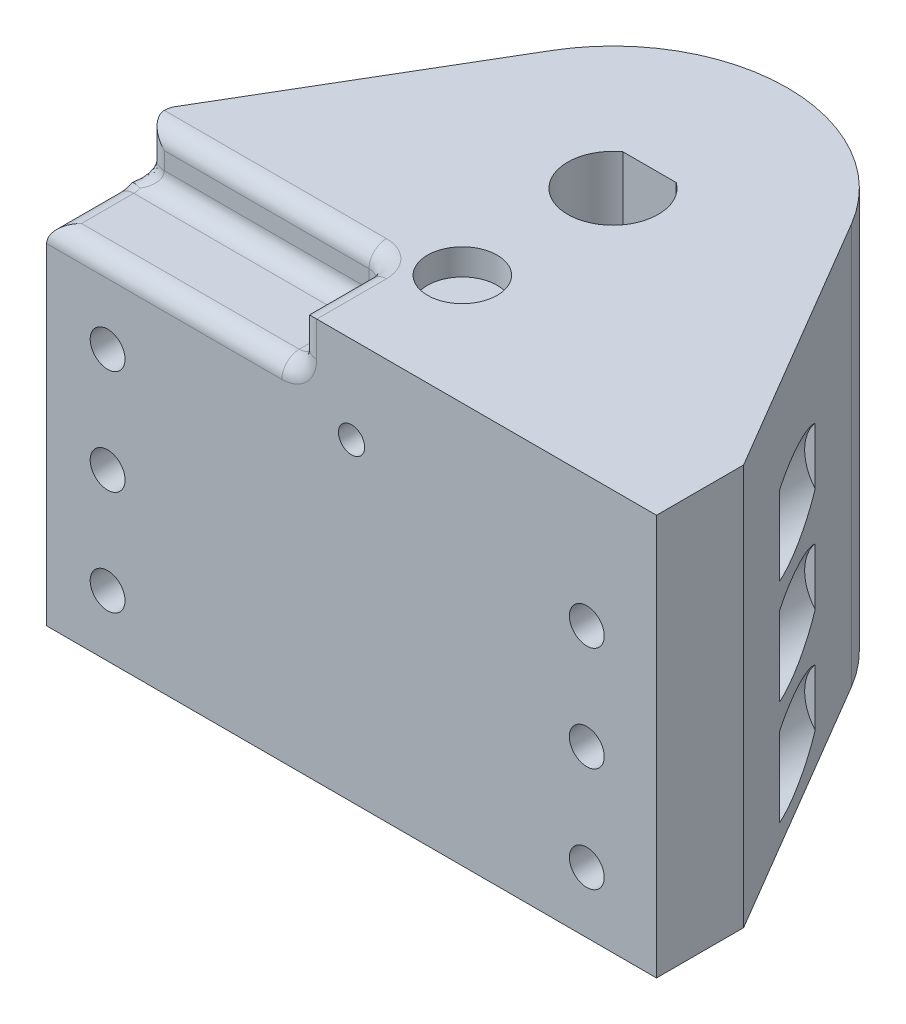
SolidWorks part; units mm, degrees
ref_plane "前视基准面" through (0, 0, 0) normal (0, 0, 1) x (1, 0, 0)
ref_plane "上视基准面" through (0, 0, 0) normal (0, 1, 0) x (1, 0, 0)
ref_plane "右视基准面" through (0, 0, 0) normal (1, 0, 0) x (0, 0, -1)
sketch "草图1" plane through (0, 0, 0) normal (0, 1, 0) x (1, 0, 0)
  line L1 (-35, 25.5) -> (-37.1794, 25.5)
  line L2 (-70, 0) -> (-52.2308, 30.1538)
  line L3 (0, 0) -> (-17.7692, 30.1538)
  line L4 (-37.3979, 25.5) -> (-32.6021, 25.5)
  line L7 (-70, 0) -> (-70, -10)
  line L8 (-70, -10) -> (0, -10)
  line L9 (0, 0) -> (0, -10)
  arc A0 (-17.7692, 30.1538) -> (-52.2308, 30.1538) centre (-35, 20) ccw
  arc A4 (-40.4, 17.3847) -> (-32.6021, 25.5) centre (-35, 20) ccw
  arc A5 (-40.4, 17.3847) -> (-40.4, 22.6153) centre (-35, 20) cw
  arc A6 (-37.3979, 25.5) -> (-40.4, 22.6153) centre (-35, 20) ccw
extrude "凸台-拉伸1" add sketch "草图1" along normal blind 40
sketch "草图2" plane through (0, 0, 10) normal (0, 0, 1) x (1, 0, 0)
  circle A0 centre (-63, 20) radius 2
  circle A1 centre (-8, 20) radius 2
  circle A2 centre (-63, 8) radius 2
  circle A3 centre (-8, 8) radius 2
  circle A4 centre (-63, 32) radius 2
  circle A5 centre (-8, 32) radius 2
extrude "切除-拉伸1" cut sketch "草图2" against normal blind 40
ref_plane "基准面1" through (0, 0, -20) normal (0, 0, 1) x (1, 0, 0)
sketch "草图3" plane through (0, 0, -20) normal (0, 0, 1) x (1, 0, 0)
  circle A0 centre (-8, 32) radius 5
  circle A1 centre (-8, 20) radius 5
  circle A2 centre (-8, 8) radius 5
  circle A3 centre (-63, 8) radius 5
  circle A4 centre (-63, 20) radius 5
  circle A5 centre (-63, 32) radius 5
  dimension "D1" = 10
  dimension "D2" = 10
  dimension "D3" = 10
  dimension "D4" = 10
  dimension "D5" = 10
  dimension "D6" = 10
extrude "切除-拉伸2" cut sketch "草图3" along normal blind 10
sketch "草图7" plane through (0, 0, 10) normal (0, 0, 1) x (1, 0, 0)
  line L0 (-70, 40) -> (-70, 0) construction
  line L1 (0, 40) -> (-70, 40)
  line L2 (0, 40) -> (0, 39)
  line L3 (0, 39) -> (-70, 39)
  line L4 (-70, 40) -> (-70, 39)
  line L6 (0, 0) -> (-70, 0)
  line L7 (0, 0) -> (0, 1)
  line L8 (0, 1) -> (-70, 1)
  line L9 (-70, 0) -> (-70, 1)
extrude "切除-拉伸5" cut sketch "草图7" against normal blind 54
sketch "草图8" plane through (0, 39, 0) normal (0, 1, 0) x (1, 0, 0)
  line L10 (-52.2308, 30.1538) -> (-70, 0)
  line L11 (-70, 0) -> (-70, -10)
  line L12 (-70, -10) -> (0, -10)
  line L13 (0, -10) -> (0, 0)
  line L14 (0, 0) -> (-17.7692, 30.1538)
  line L15 (-52.2308, 30.1538) -> (-70, 0)
  line L16 (-70, 0) -> (-70, -10)
  line L17 (-70, -10) -> (0, -10)
  line L18 (0, -10) -> (0, 0)
  line L19 (0, 0) -> (-17.7692, 30.1538)
  line L38 (-32.6021, 25.5) -> (-37.3979, 25.5)
  line L39 (-32.6021, 25.5) -> (-37.3979, 25.5)
  arc A2 (-17.7692, 30.1538) -> (-52.2308, 30.1538) centre (-35, 20) ccw
  arc A3 (-17.7692, 30.1538) -> (-52.2308, 30.1538) centre (-35, 20) ccw
  arc A9 (-37.3979, 25.5) -> (-32.6021, 25.5) centre (-35, 20) ccw
  arc A10 (-37.3979, 25.5) -> (-32.6021, 25.5) centre (-35, 20) ccw
  dimension "D1" = 0
  dimension "D2" = 0
extrude "凸台-拉伸2" add sketch "草图8" along normal blind 8
sketch "草图9" plane through (0, 0, 10) normal (0, 0, 1) x (1, 0, 0)
  line L0 (-70, 47) -> (0, 47) construction
  circle A0 centre (-35, 37) radius 1.5
  dimension "D1" = 10
extrude "切除-拉伸6" cut sketch "草图9" against normal blind 74
sketch "草图10" plane through (0, 47, 0) normal (0, 1, 0) x (1, 0, 0)
  circle A0 centre (-35, 2.7133) radius 4
  dimension "D1" = 8
extrude "切除-拉伸7" cut sketch "草图10" against normal blind 3
sketch "草图11" plane through (0, 47, 0) normal (0, 1, 0) x (1, 0, 0)
  line L0 (-32.8206, 24.5) -> (-37.1794, 24.5)
  line L11 (-32.6021, 25.5) -> (-37.3979, 25.5)
  line L12 (-32.6021, 25.5) -> (-37.3979, 25.5)
  arc A0 (-37.1794, 24.5) -> (-32.8206, 24.5) centre (-35, 20) ccw
  arc A7 (-37.3979, 25.5) -> (-32.6021, 25.5) centre (-35, 20) ccw
  arc A8 (-37.3979, 25.5) -> (-32.6021, 25.5) centre (-35, 20) ccw
  dimension "D2" = 0
extrude "凸台-拉伸3" add sketch "草图11" against normal up to surface (46 mm away)
sketch "草图13" plane through (0, 1, 0) normal (0, -1, 0) x (1, 0, 0)
  line L11 (-37.1794, -24.5) -> (-32.8206, -24.5)
  line L12 (-37.1794, -24.5) -> (-32.8206, -24.5)
  arc A10 (-32.8206, -24.5) -> (-37.1794, -24.5) centre (-35, -20) ccw
  arc A11 (-32.8206, -24.5) -> (-37.1794, -24.5) centre (-35, -20) ccw
  dimension "D3" = 0
extrude "凸台-拉伸4" add sketch "草图13" against normal blind 15
sketch "草图14" plane through (0, 1, 0) normal (0, -1, 0) x (1, 0, 0)
  circle A0 centre (-35.1438, -4.0006) radius 1.5
  circle A1 centre (-50.9994, -20.1438) radius 1.5
  circle A2 centre (-34.8562, -35.9994) radius 1.5
  circle A3 centre (-19.0006, -19.8562) radius 1.5
  circle A4 centre (-35.1438, -19.8562) radius 1.5
extrude "切除-拉伸8" cut sketch "草图14" against normal blind 20
sketch "草图15" plane through (0, 0, 10) normal (0, 0, 1) x (1, 0, 0)
  circle A0 centre (-35, 37) radius 1.5
extrude "切除-拉伸9" cut sketch "草图15" against normal blind 57
sketch "草图16" plane through (0, 47, 0) normal (0, 1, 0) x (1, 0, 0)
  line L2 (-35, 24) -> (-38, 24)
  line L3 (-38, 24) -> (-32, 24)
  line L7 (-32.8206, 24.5) -> (-37.1794, 24.5)
  line L8 (-32.8206, 24.5) -> (-37.1794, 24.5)
  arc A0 (-37.1794, 24.5) -> (-32.8206, 24.5) centre (-35, 20) ccw construction
  arc A3 (-32, 24) -> (-32.8206, 24.5) centre (-35, 20) ccw
  arc A4 (-37.1794, 24.5) -> (-32.8206, 24.5) centre (-35, 20) ccw
  arc A5 (-37.1794, 24.5) -> (-38, 24) centre (-35, 20) ccw
  dimension "D1" = 0
extrude "凸台-拉伸5" add sketch "草图16" against normal up to surface (31 mm away) contours L3 A3 L8 A5
sketch "草图17" plane through (0, 0, 10) normal (0, 0, 1) x (1, 0, 0)
  circle A0 centre (-35, 37) radius 1.5
extrude "切除-拉伸10" cut sketch "草图17" against normal blind 57
sketch "草图19" plane through (0, 0, 10) normal (0, 0, 1) x (1, 0, 0)
  line L1 (-70, 47) -> (-41, 47)
  line L2 (-70, 47) -> (-70, 41)
  line L3 (-70, 41) -> (-41, 41)
  line L4 (-41, 47) -> (-41, 41)
extrude "切除-拉伸12" cut sketch "草图19" against normal blind 10
fillet "圆角1" radius 2 3 edges at (-41, 41, 5) (-55.5, 41, 0) (-41, 44, 0)
fillet "圆角2" radius 2 9 edges at (-56.5, 41, 10) (-41.5858, 41.5858, 10) (-41, 47, 6) (-41.5858, 47, 0.5858) (-70, 41.5858, 0.5858) (-41, 45, 10) (-56.5, 47, 0) (-70, 41, 6) (-70, 45, 0)
sketch "草图20" plane through (0, 47, 0) normal (0, 1, 0) x (1, 0, 0)
  line L2 (-31.9341, 24.2) -> (-38.0659, 24.2)
  line L3 (-32, 24) -> (-38, 24)
  line L4 (-32, 24) -> (-38, 24)
  arc A1 (-38.0659, 24.2) -> (-31.9341, 24.2) centre (-35, 20) ccw
  arc A2 (-38, 24) -> (-32, 24) centre (-35, 20) ccw
  arc A3 (-38, 24) -> (-32, 24) centre (-35, 20) ccw
  dimension "D1" = 0
  dimension "D2" = 0.2
extrude "切除-拉伸13" cut sketch "草图20" against normal up to surface (31 mm away)
